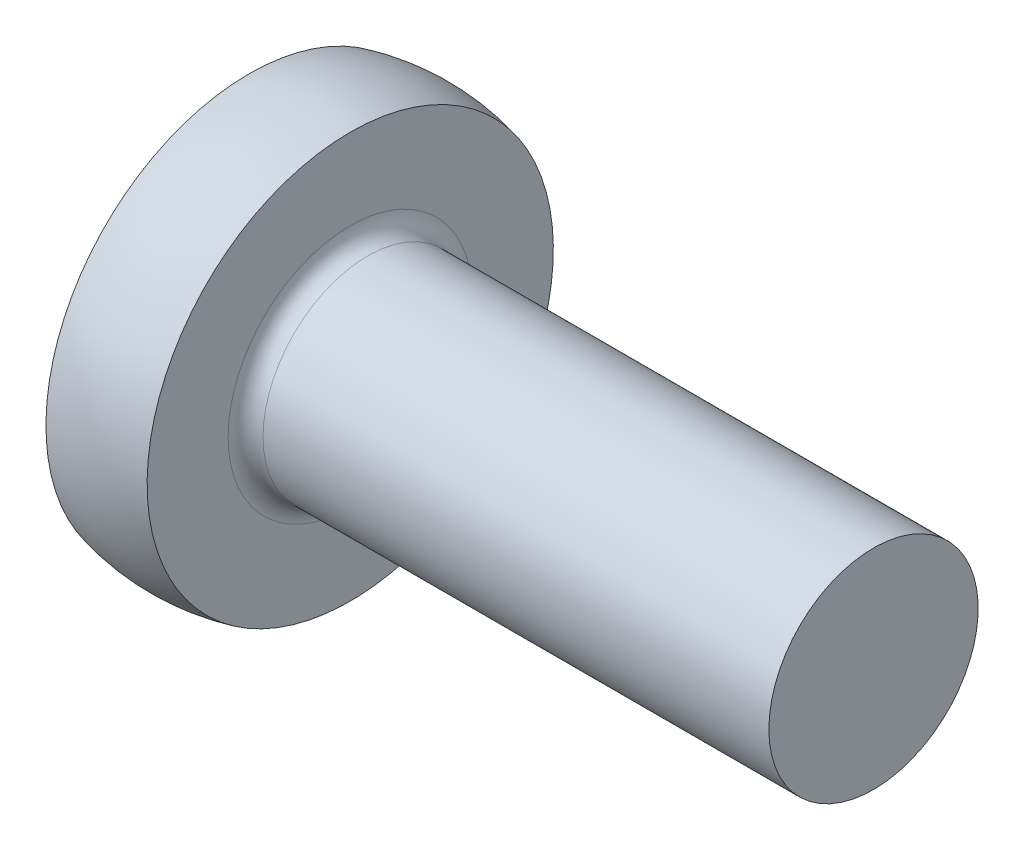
SolidWorks part; units mm, degrees
ref_plane "Front" through (0, 0, 0) normal (0, 0, 1) x (1, 0, 0)
ref_plane "Top" through (0, 0, 0) normal (0, 1, 0) x (1, 0, 0)
ref_plane "Right" through (0, 0, 0) normal (1, 0, 0) x (0, 0, -1)
sketch "Sketch1" plane through (0, 0, 0) normal (0, 0, 1) x (1, 0, 0)
  line L0 (0, 1.1644) -> (0, 0)
  line L1 (0.58, 1.1644) -> (0.58, 0.6)
  line L2 (0, 0) -> (3.58, 0)
  line L3 (3.58, 0) -> (3.58, 0.6)
  line L4 (3.58, 0.6) -> (0.58, 0.6)
  line L5 (-2.3183, 0) -> (6.9456, 0) construction
  arc A0 (0.58, 1.1644) -> (0, 1.1644) centre (0.29, 0) ccw
  dimension "dk" = 2.4
  dimension "K" = 0.58
  dimension "D3" = 0.29
  dimension "l" = 3
  dimension "d" = 1.2
revolve "Base-Revolve" add sketch "Sketch1" angle 360 about L5
fillet "Fillet1" radius 0.1 1 edges at (0.58, 0, 0.6)
equation "\"D3@Sketch1\" = \"K@Sketch1\" / 2"
